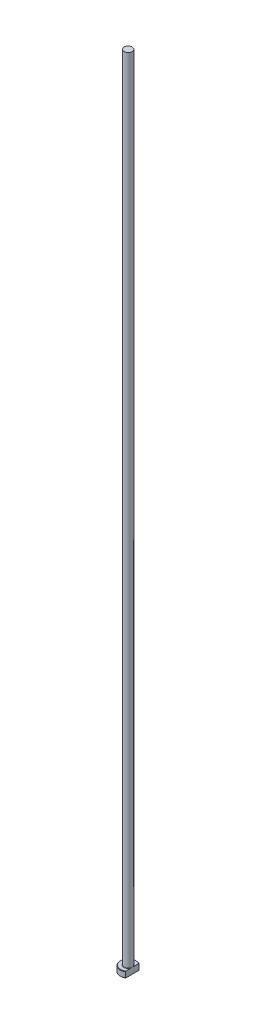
SolidWorks part; units mm, degrees
ref_plane "Front Plane" through (0, 0, 0) normal (0, 0, 1) x (1, 0, 0)
ref_plane "Top Plane" through (0, 0, 0) normal (0, 1, 0) x (1, 0, 0)
ref_plane "Right Plane" through (0, 0, 0) normal (1, 0, 0) x (0, 0, -1)
sketch "Sketch1" plane through (0, 0, 0) normal (0, 0, 1) x (1, 0, 0)
  line L0 (0, 259.9588) -> (0, -15.1925) construction
  line L1 (0, 0) -> (-4, 0)
  line L2 (-4, 0) -> (-4, 3)
  line L3 (-4, 3) -> (-2, 3)
  line L4 (-2, 3) -> (-2, 400)
  line L5 (-2, 400) -> (0, 400)
  line L6 (0, 400) -> (0, 0)
  dimension "L" = 400
  dimension "H" = 8
  dimension "T" = 3
  dimension "D" = 4
revolve "Revolve1" add sketch "Sketch1" angle 360 about L0
chamfer "Chamfer1" distance 0.2 angle 45 2 edges at (0, 3, 4) (0, 0, 4)
fillet "Fillet1" radius 0.2 1 edges at (0, 3, 2)
sketch "Sketch2" plane through (0, 0, 0) normal (0, 1, 0) x (1, 0, 0)
  line L0 (2, 3.4641) -> (2, -3.4641)
  circle A0 centre (0, 0) radius 4 construction
  arc A1 (2, -3.4641) -> (2, 3.4641) centre (0, 0) ccw
  circle A2 centre (0, 0) radius 2 construction
extrude "KEY" cut sketch "Sketch2" along normal through all
